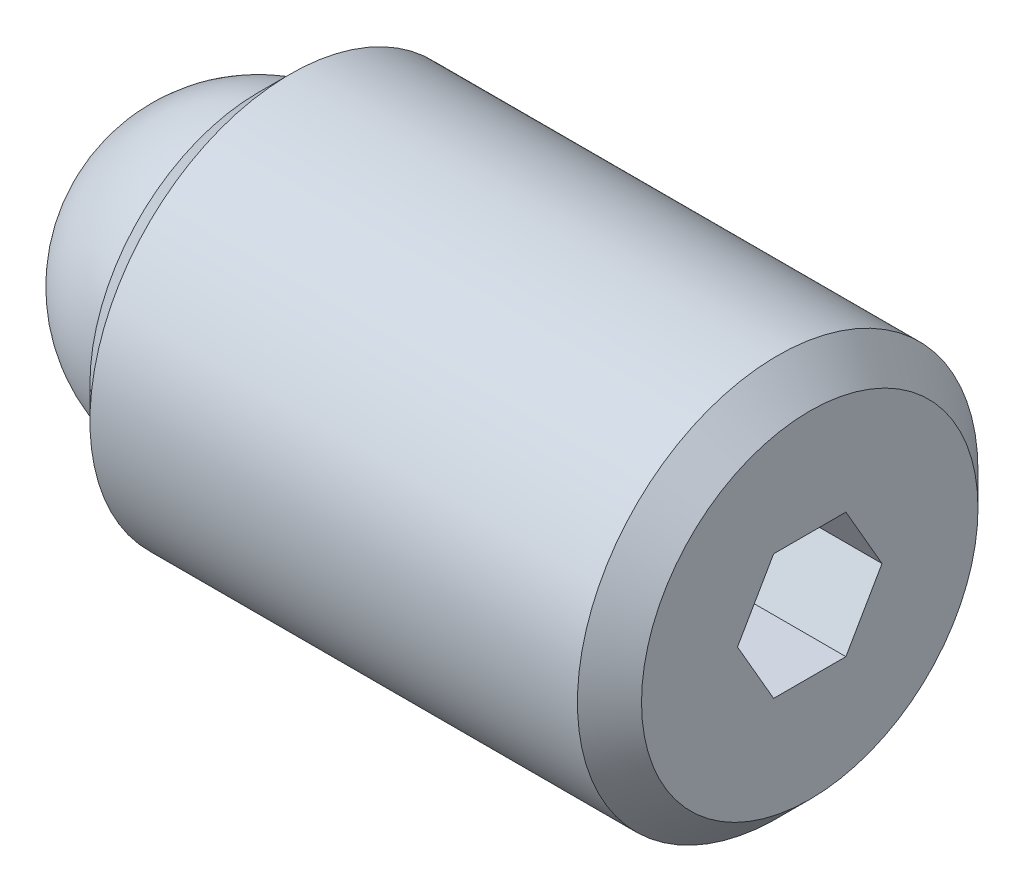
SolidWorks part; units mm, degrees
ref_plane "Front Plane" through (0, 0, 0) normal (0, 0, 1) x (1, 0, 0)
ref_plane "Top Plane" through (0, 0, 0) normal (0, 1, 0) x (1, 0, 0)
ref_plane "Right Plane" through (0, 0, 0) normal (1, 0, 0) x (0, 0, -1)
sketch "Sketch2" plane through (0, 0, 0) normal (1, 0, 0) x (0, 0, -1)
  circle A0 centre (0, 0) radius 3.175
  dimension "D1" = 6.35
extrude "Boss-Extrude1" add sketch "Sketch2" along normal blind 8.7439
sketch "Sketch3" plane through (0, 0, 0) normal (-1, 0, 0) x (0, 0, 1)
  circle A0 centre (0, 0) radius 2.3813
  dimension "D1" = 4.7625
chamfer "Chamfer1" distance 0.508 angle 45 1 edges at (0, 0, -3.175)
chamfer "Chamfer2" distance 0.508 angle 45 1 edges at (8.7439, 0, -3.175)
sketch "Sketch4" plane through (8.7439, 0, 0) normal (1, 0, 0) x (0, 0, -1)
  line L1 (1.1457, 0) -> (0.5728, 0.9922)
  line L2 (0.5728, 0.9922) -> (-0.5728, 0.9922)
  line L3 (-0.5728, 0.9922) -> (-1.1457, 0)
  line L4 (-1.1457, 0) -> (-0.5728, -0.9922)
  line L5 (-0.5728, -0.9922) -> (0.5728, -0.9922)
  line L6 (0.5728, -0.9922) -> (1.1457, 0)
  circle A0 centre (0, 0) radius 0.9922 construction
  dimension "D1" = 1.9844
extrude "Cut-Extrude2" cut sketch "Sketch4" against normal blind 2.286
extrude "Cut-Extrude3" cut sketch "Sketch3" against normal blind 1.9844
sketch "Sketch5" plane through (0, 0, 0) normal (-1, 0, 0) x (0, 0, 1)
  line L0 (0, 0) -> (0, -2.3813)
  line L1 (0, 0) -> (0, 2.3813)
  arc A0 (0, 2.3813) -> (0, -2.3813) centre (0, 0) ccw
  dimension "D1" = 2.3813
revolve "Revolve1" add sketch "Sketch5" angle 360 about L1
